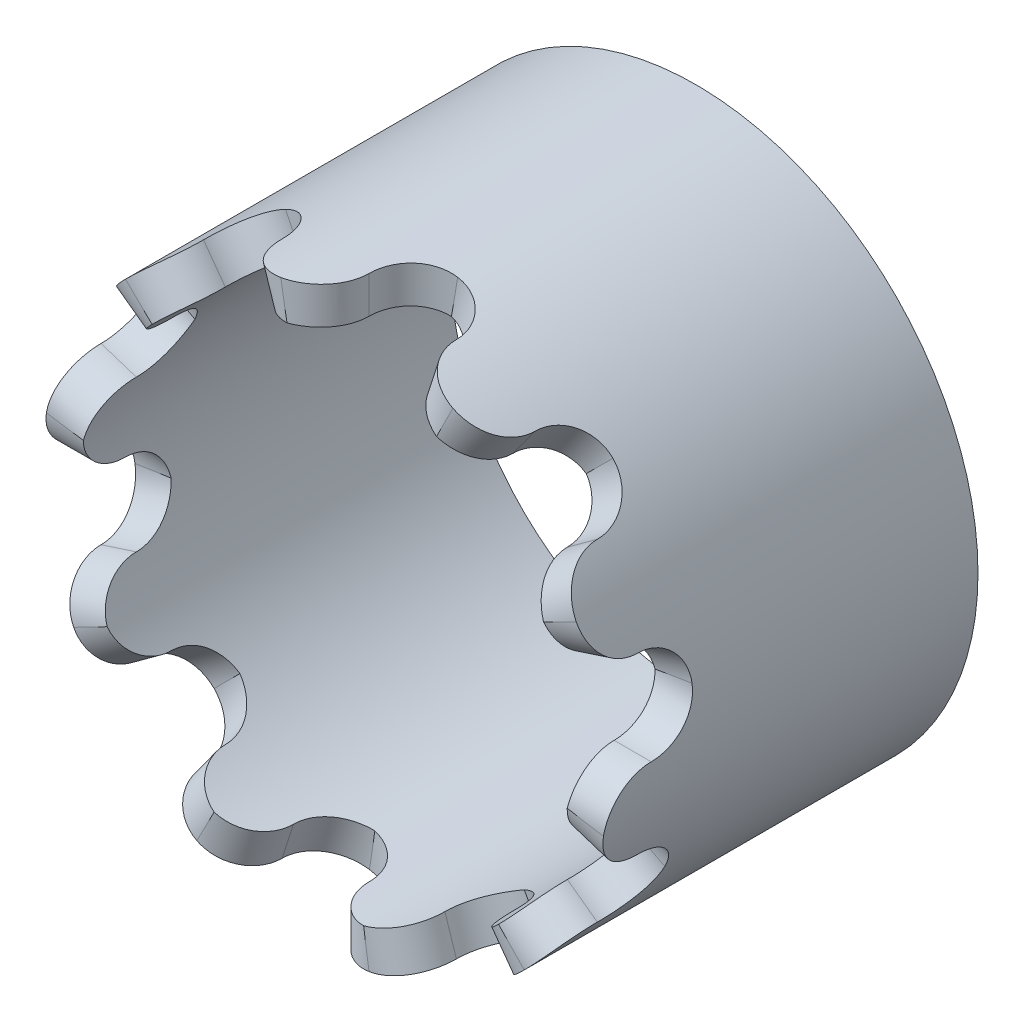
SolidWorks part; units mm, degrees
ref_plane "Ebene vorne" through (0, 0, 0) normal (0, 0, 1) x (1, 0, 0)
ref_plane "Ebene oben" through (0, 0, 0) normal (0, 1, 0) x (1, 0, 0)
ref_plane "Ebene rechts" through (0, 0, 0) normal (1, 0, 0) x (0, 0, -1)
sketch "Skizze1" plane through (0, 0, 0) normal (0, 0, 1) x (1, 0, 0)
  circle A0 centre (0, 0) radius 3.8
  circle A1 centre (0, 0) radius 3.3
  dimension "D1" = 7.6
  dimension "D2" = 6.6
extrude "Linear austragen1" add sketch "Skizze1" along normal blind 5
sketch "Skizze2" plane through (0, 0, 5) normal (0, 0, 1) x (1, 0, 0)
  line L0 (0, 3.3) -> (0, 3.8)
  line L1 (1.0198, 3.1385) -> (1.1743, 3.614)
  line L2 (-1.9397, 2.6698) -> (-2.2336, 3.0743)
  line L3 (-1.0198, 3.1385) -> (-1.1743, 3.614)
  line L4 (-3.1385, 1.0198) -> (-3.614, 1.1743)
  line L5 (-2.6698, 1.9397) -> (-3.0743, 2.2336)
  line L6 (-3.1385, -1.0198) -> (-3.614, -1.1743)
  line L7 (-3.3, 0) -> (-3.8, 0)
  line L8 (-1.9397, -2.6698) -> (-2.2336, -3.0743)
  line L9 (-2.6698, -1.9397) -> (-3.0743, -2.2336)
  line L10 (0, -3.3) -> (0, -3.8)
  line L11 (-1.0198, -3.1385) -> (-1.1743, -3.614)
  line L12 (1.9397, -2.6698) -> (2.2336, -3.0743)
  line L13 (1.0198, -3.1385) -> (1.1743, -3.614)
  line L14 (3.1385, -1.0198) -> (3.614, -1.1743)
  line L15 (2.6698, -1.9397) -> (3.0743, -2.2336)
  line L16 (3.1385, 1.0198) -> (3.614, 1.1743)
  line L17 (3.3, 0) -> (3.8, 0)
  line L18 (1.9397, 2.6698) -> (2.2336, 3.0743)
  line L19 (2.6698, 1.9397) -> (3.0743, 2.2336)
  arc A0 (1.0198, 3.1385) -> (0, 3.3) centre (0, 0) ccw
  arc A1 (1.1743, 3.614) -> (0, 3.8) centre (0, 0) ccw
  arc A2 (3.0743, 2.2336) -> (2.2336, 3.0743) centre (0, 0) ccw
  arc A3 (2.6698, 1.9397) -> (1.9397, 2.6698) centre (0, 0) ccw
  arc A4 (3.8, 0) -> (3.614, 1.1743) centre (0, 0) ccw
  arc A5 (3.3, 0) -> (3.1385, 1.0198) centre (0, 0) ccw
  arc A6 (3.0743, -2.2336) -> (3.614, -1.1743) centre (0, 0) ccw
  arc A7 (2.6698, -1.9397) -> (3.1385, -1.0198) centre (0, 0) ccw
  arc A8 (1.0198, -3.1385) -> (1.9397, -2.6698) centre (0, 0) ccw
  arc A9 (1.1743, -3.614) -> (2.2336, -3.0743) centre (0, 0) ccw
  arc A10 (-1.0198, -3.1385) -> (0, -3.3) centre (0, 0) ccw
  arc A11 (-1.1743, -3.614) -> (0, -3.8) centre (0, 0) ccw
  arc A12 (-2.6698, -1.9397) -> (-1.9397, -2.6698) centre (0, 0) ccw
  arc A13 (-3.0743, -2.2336) -> (-2.2336, -3.0743) centre (0, 0) ccw
  arc A14 (-3.3, 0) -> (-3.1385, -1.0198) centre (0, 0) ccw
  arc A15 (-3.8, 0) -> (-3.614, -1.1743) centre (0, 0) ccw
  arc A16 (-2.6698, 1.9397) -> (-3.1385, 1.0198) centre (0, 0) ccw
  arc A17 (-3.0743, 2.2336) -> (-3.614, 1.1743) centre (0, 0) ccw
  arc A18 (-1.0198, 3.1385) -> (-1.9397, 2.6698) centre (0, 0) ccw
  arc A19 (-1.1743, 3.614) -> (-2.2336, 3.0743) centre (0, 0) ccw
  arc A20 (-2.0866, 2.872) -> (1.097, 3.3763) centre (0, 0) ccw construction
  arc A21 (0, 3.55) -> (-1.097, 3.3763) centre (0, 0) ccw construction
  dimension "D2" = 3.8
  dimension "D3" = 3.3
  dimension "D4" = 7.1
  dimension "D1" = 18
extrude "Schnitt-Linear austragen1" cut sketch "Skizze2" against normal blind 1.1938
fillet "Verrundung1" radius 0.5969 20 edges at (0, 3.55, 5) (-1.097, 3.3763, 5) (-2.0866, 2.872, 5) (-3.3763, 1.097, 5) (-3.3763, -1.097, 5) (-2.0866, -2.872, 5) (0, -3.55, 5) (2.0866, -2.872, 5) (3.3763, -1.097, 5) (3.3763, 1.097, 5) (2.0866, 2.872, 5) (-2.872, 2.0866, 5) (-3.55, 0, 5) (-2.872, -2.0866, 5) (-1.097, -3.3763, 5) (1.097, -3.3763, 5) (2.872, -2.0866, 5) (3.55, 0, 5) (2.872, 2.0866, 5) (1.097, 3.3763, 5)
fillet "Verrundung2" radius 0.5969 20 edges at (0, 3.55, 3.8062) (1.097, 3.3763, 3.8062) (-2.0866, 2.872, 3.8062) (-1.097, 3.3763, 3.8062) (2.872, 2.0866, 3.8062) (3.55, 0, 3.8062) (2.872, -2.0866, 3.8062) (1.097, -3.3763, 3.8062) (-1.097, -3.3763, 3.8062) (-2.872, -2.0866, 3.8062) (-3.55, 0, 3.8062) (-2.872, 2.0866, 3.8062) (-3.3763, 1.097, 3.8062) (-3.3763, -1.097, 3.8062) (-2.0866, -2.872, 3.8062) (0, -3.55, 3.8062) (2.0866, -2.872, 3.8062) (3.3763, -1.097, 3.8062) (3.3763, 1.097, 3.8062) (2.0866, 2.872, 3.8062)
